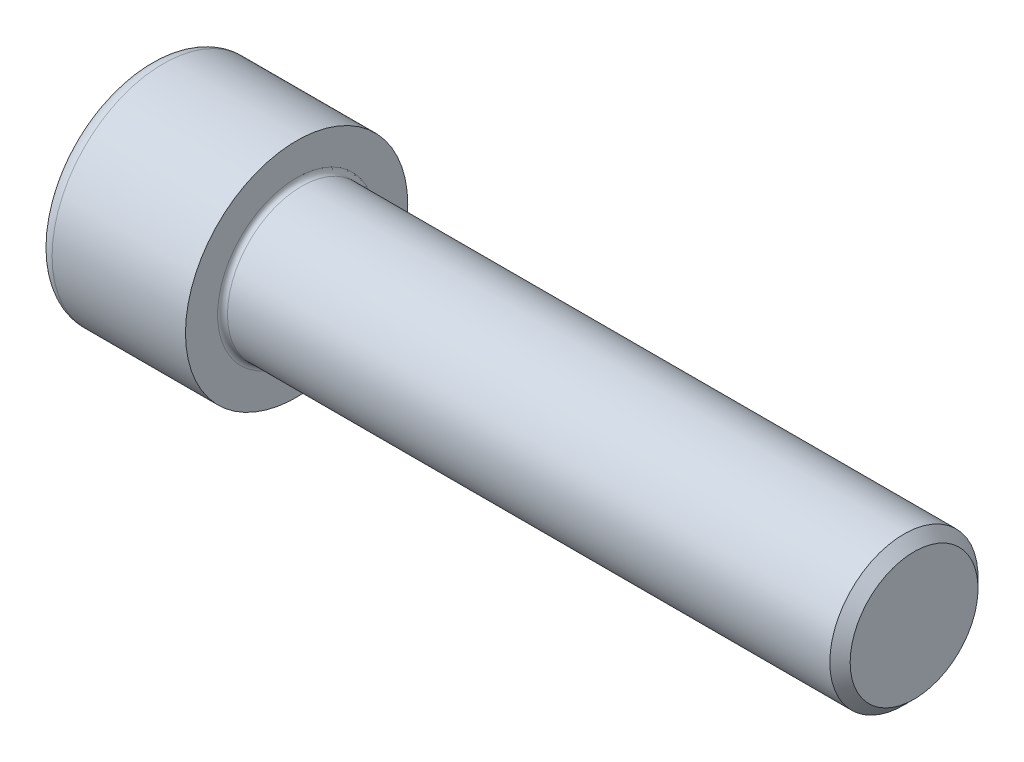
SolidWorks part; units mm, degrees
ref_plane "Front Plane" through (0, 0, 0) normal (0, 0, 1) x (1, 0, 0)
ref_plane "Top Plane" through (0, 0, 0) normal (0, 1, 0) x (1, 0, 0)
ref_plane "Right Plane" through (0, 0, 0) normal (1, 0, 0) x (0, 0, -1)
sketch "BaseHeadSke" plane through (0, 0, 0) normal (1, 0, 0) x (0, 0, -1)
  circle A1 centre (0, 0) radius 18
  dimension "Head_diameter" = 36
extrude "BaseHead" add sketch "BaseHeadSke" along normal blind 24
sketch "BodySke" plane through (0, 0, 0) normal (0, 0, 1) x (1, 0, 0)
  line L0 (0, 0) -> (124, 0)
  line L1 (124, 0) -> (124, 10.352)
  line L2 (124, 10.352) -> (122.352, 12)
  line L3 (122.352, 12) -> (0, 12)
  line L4 (0, 12) -> (0, 0)
  line L6 (0, 0) -> (159.3976, 0) construction
  line L7 (64, -84.3176) -> (64, 77.7215) construction
  line L8 (121, -21.5941) -> (121, 39.2994) construction
  line L10 (24, -18) -> (24, 18) construction
  dimension "Ang" = 45
  dimension "Length" = 100
  dimension "Diameter" = 24
  dimension "Minor_dia" = 20.704
  dimension "Thread_length" = 60
  dimension "Advance" = 3
revolve "BaseBody" add sketch "BodySke" angle 360 about L6
sketch "CutSocketSke" plane through (0, 0, 0) normal (1, 0, 0) x (0, 0, -1)
  line L1 (0, 10.9697) -> (-9.5, 5.4848)
  line L2 (-9.5, 5.4848) -> (-9.5, -5.4848)
  line L3 (-9.5, -5.4848) -> (0, -10.9697)
  line L4 (0, -10.9697) -> (9.5, -5.4848)
  line L5 (9.5, -5.4848) -> (9.5, 5.4848)
  line L6 (9.5, 5.4848) -> (0, 10.9697)
  circle A0 centre (0, 0) radius 9.5 construction
  dimension "Socket_width" = 19
extrude "CutSocket" cut sketch "CutSocketSke" along normal blind 12
sketch "CutHoleSke" plane through (0, 0, 0) normal (0, 0, 1) x (1, 0, 0)
  line L0 (0, 0) -> (149.4323, 0) construction
  line L1 (0, 9.5) -> (13.6, 9.5)
  line L2 (13.6, 9.5) -> (19.0848, 0)
  line L3 (19.0848, 0) -> (0, 0)
  line L4 (0, 0) -> (0, 9.5)
  line L6 (24, -18) -> (24, 18) construction
  dimension "D1" = 60
  dimension "D2" = 19
  dimension "Hole_depth" = 10.4
revolve "CutHole" cut sketch "CutHoleSke" angle 360 about L0
fillet "Fillet1" radius 0.8 1 edges at (24, 0, -12)
fillet "Fillet2" radius 2.4 1 edges at (0, 0, -18)
sketch "ThdSchSke" plane through (0, 0, 0) normal (0, 0, 1) x (1, 0, 0)
  line L0 (120.0485, 13.9029) -> (120.0485, 12)
  line L1 (120.0485, 12) -> (121, 10.352)
  line L2 (121, 10.352) -> (121.9515, 12)
  line L3 (121.9515, 12) -> (121.9515, 13.9029)
  line L4 (121.9515, 13.9029) -> (120.0485, 13.9029)
  line L6 (0, 0) -> (141.9934, 0) construction
  line L7 (124, -10.352) -> (124, 10.352) construction
  dimension "D2" = 20.704
  dimension "D3" = 24
  dimension "Advance" = 3
revolve "ThreadSchematic" [suppressed] cut sketch "ThdSchSke" angle 360 about L6
pattern_linear "ThdSchPat" [suppressed] count 19 spacing 3 along (1, 0, 0)
equation "\"Thread_minor@ThreadCosmetic\" = \"Minor_dia@BodySke\""
equation "\"Thread_length@ThreadCosmetic\" = \"Thread_length@BodySke\""
equation "\"D2@CutHoleSke\" = \"Socket_width@CutSocketSke\""
equation "\"D2@ThdSchSke\" = \"Minor_dia@BodySke\""
equation "\"D3@ThdSchSke\" = \"Diameter@BodySke\""
equation "\"Advance@ThdSchSke\" = \"Advance@BodySke\""
equation "\"D3@ThdSchPat\" = \"Advance@BodySke\""
equation "\"D1@ThdSchPat\" =  int( \"Thread_length@BodySke\"/\"Advance@BodySke\" )-1"
